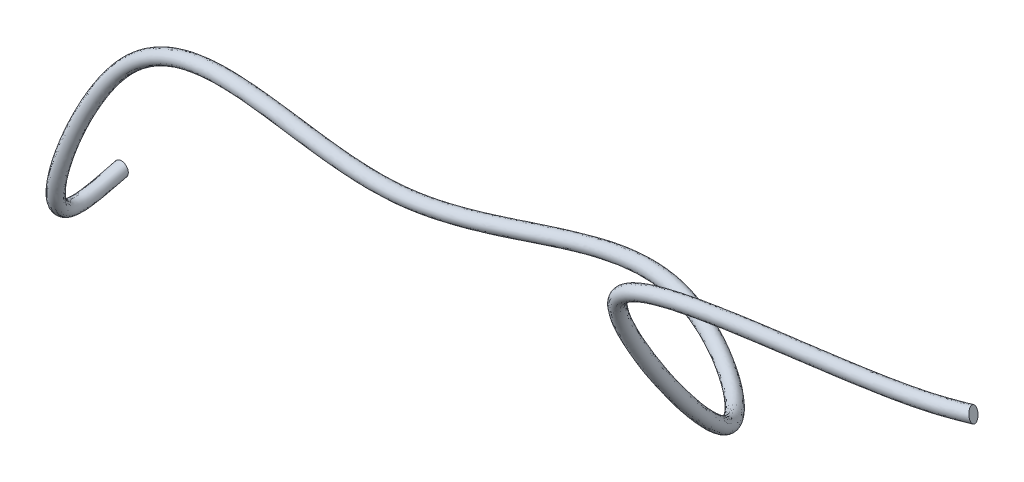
SolidWorks part; units mm, degrees
ref_plane "Plan de face" through (0, 0, 0) normal (0, 0, 1) x (1, 0, 0)
ref_plane "Plan de dessus" through (0, 0, 0) normal (0, 1, 0) x (1, 0, 0)
ref_plane "Plan de droite" through (0, 0, 0) normal (1, 0, 0) x (0, 0, -1)
sketch "Esquisse1" plane through (0, 0, 0) normal (0, 0, 1) x (1, 0, 0)
  circle A0 centre (7.6956, 5.9959) radius 0.2083
sketch3d "Esquisse3D1"
  spline S0 degree 3 poles (7.6956, 5.9959, 0) (7.6897, 5.8438, 0.5615) (7.664, 5.1836, 2.9987) (9.3279, 13.6314, 1.313) (17.6175, 9.7161, 2.2251) (23.4771, 12.0503, -1.2748) (30.514, 9.7995, 3.118) (26.6719, 19.0807, 8.0415) (34.4989, 16.232, 4.8694) (37.3445, 16.7447, 4.455) (37.6709, 16.8036, 4.4075) knots 0 0 0 0 0.036539 0.158598 0.34322 0.516755 0.640472 0.786111 0.975468 1 1 1 1
sweep "Balayage1" add profiles "Esquisse1" path "Esquisse3D1"
